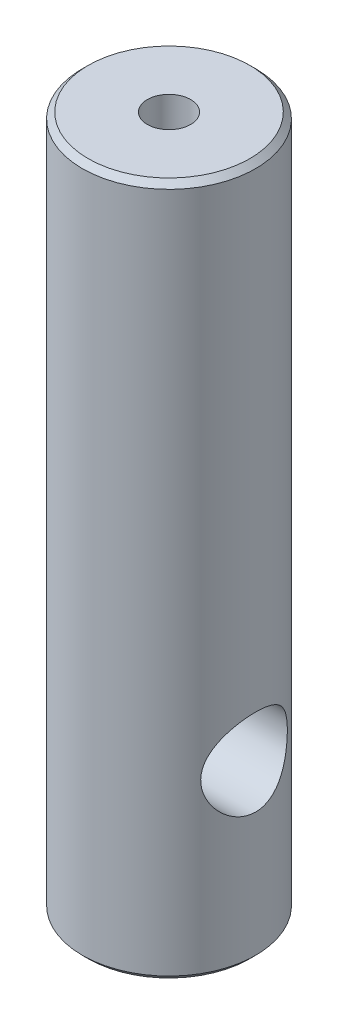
SolidWorks part; units mm, degrees
ref_plane "Front Plane" through (0, 0, 0) normal (0, 0, 1) x (1, 0, 0)
ref_plane "Top Plane" through (0, 0, 0) normal (0, 1, 0) x (1, 0, 0)
ref_plane "Right Plane" through (0, 0, 0) normal (1, 0, 0) x (0, 0, -1)
sketch "Sketch1" plane through (0, 0, 0) normal (0, 1, 0) x (1, 0, 0)
  circle A0 centre (0, 0) radius 9.525
  dimension "D1" = 19.05
extrude "Boss-Extrude1" add sketch "Sketch1" along normal blind 76.2
sketch "Sketch2" plane through (0, 76.2, 0) normal (0, 1, 0) x (1, 0, 0)
  circle A0 centre (0, 0) radius 2.3813
  dimension "D1" = 4.7625
extrude "Cut-Extrude1" cut sketch "Sketch2" against normal blind 38.1
sketch "Sketch3" plane through (0, 0, 0) normal (1, 0, 0) x (0, 0, -1)
  circle A0 centre (0, 19.05) radius 4.7625
  point P2 (0, 0)
  dimension "D1" = 19.05
  dimension "D2" = 9.525
extrude "Cut-Extrude2" cut sketch "Sketch3" against normal mid plane 38.1
chamfer "Chamfer1" distance 0.635 angle 45 2 edges at (0, 0, 9.525) (0, 76.2, 9.525)
